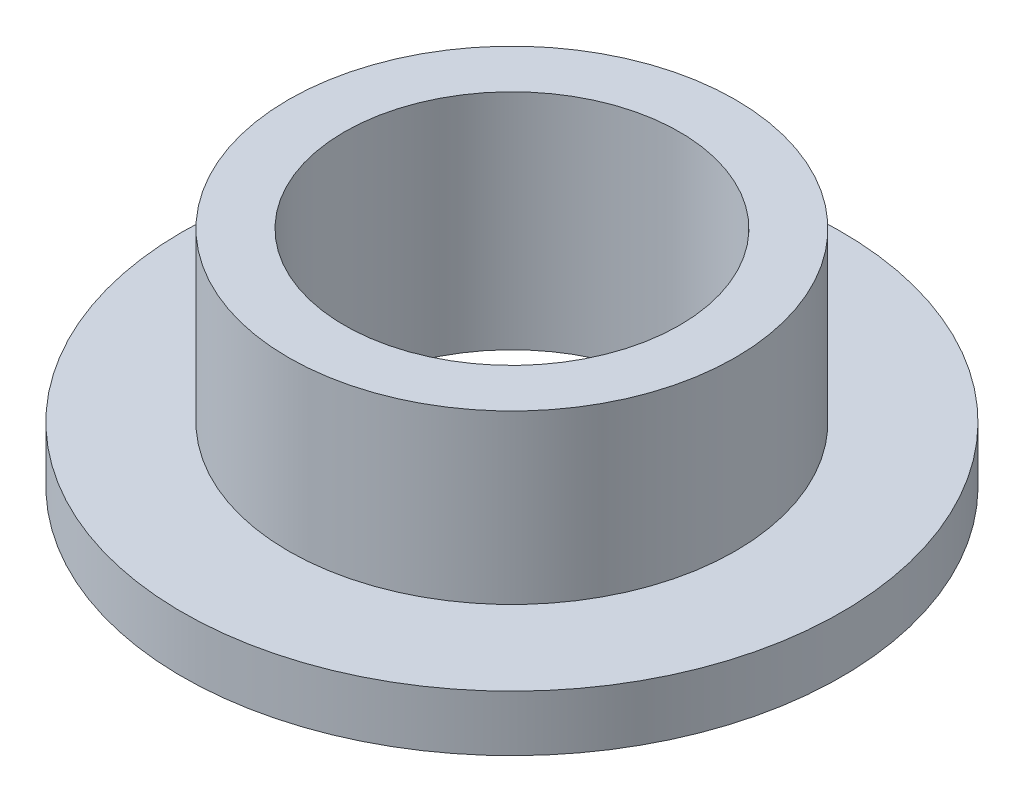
SolidWorks part; units mm, degrees
ref_plane "Front Plane" through (0, 0, 0) normal (0, 0, 1) x (1, 0, 0)
ref_plane "Top Plane" through (0, 0, 0) normal (0, 1, 0) x (1, 0, 0)
ref_plane "Right Plane" through (0, 0, 0) normal (1, 0, 0) x (0, 0, -1)
sketch "Sketch1" plane through (0, 0, 0) normal (0, 0, 1) x (1, 0, 0)
  line L0 (0, 25.2723) -> (0, -33.6422) construction
  line L1 (0, -1.375) -> (0, 1.375) construction
  line L2 (2, 0) -> (2.95, 0)
  line L3 (3.245, 0) -> (-3.245, 0) construction
  line L4 (2.95, 0) -> (2.95, -0.5)
  line L5 (2.95, -0.5) -> (1.5, -0.5)
  line L6 (1.5, -0.5) -> (1.5, 1.5)
  line L7 (1.5, 1.5) -> (2, 1.5)
  line L8 (2, 1.5) -> (2, 0)
  dimension "D1" = 3
  dimension "D2" = 4
  dimension "D3" = 2
  dimension "D4" = 0.5
  dimension "D5" = 5.9
revolve "Revolve1" add sketch "Sketch1" angle 360 about L0
